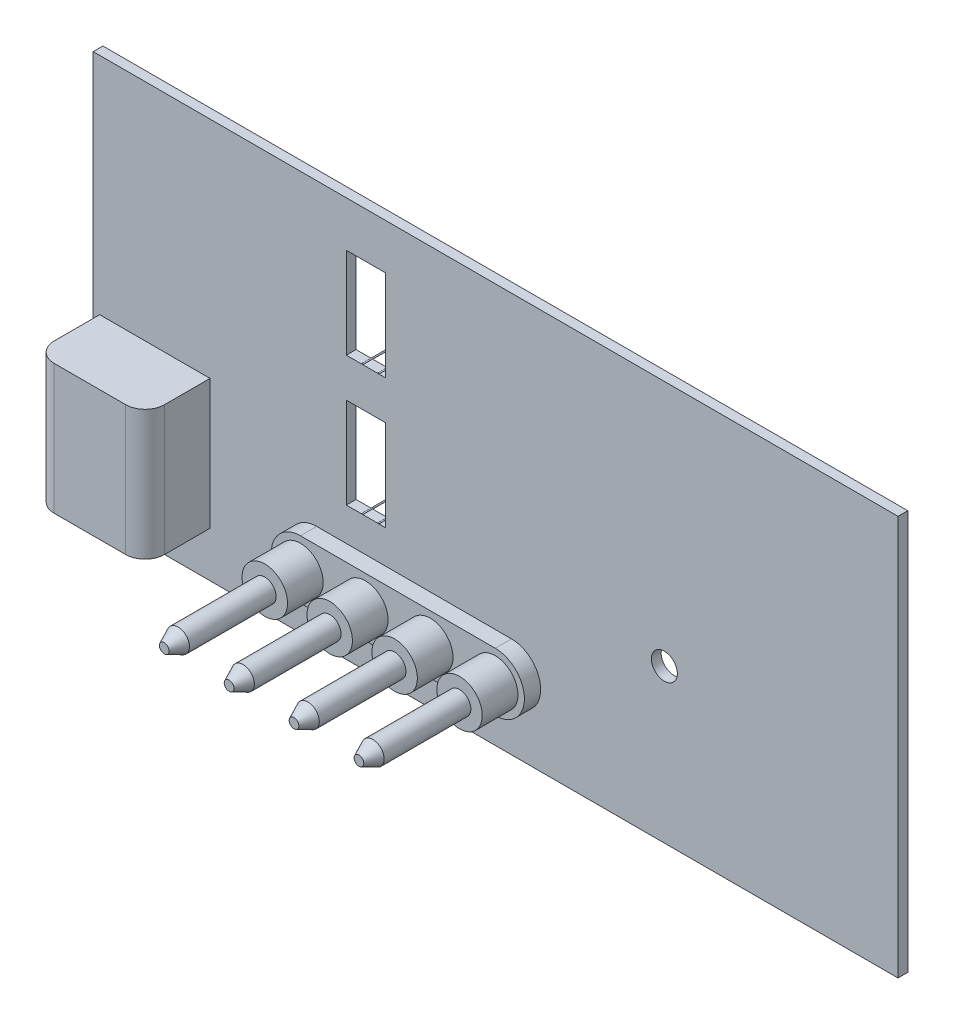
SolidWorks part; units mm, degrees
ref_plane "Plan1" through (0, 0, 0) normal (0, 0, 1) x (1, 0, 0)
ref_plane "Plan2" through (0, 0, 0) normal (0, 1, 0) x (1, 0, 0)
ref_plane "Plan3" through (0, 0, 0) normal (1, 0, 0) x (0, 0, -1)
sketch "Esquisse1" plane through (0, 0, 0) normal (0, 0, 1) x (1, 0, 0)
  line L1 (-88, 38) -> (36, 38)
  line L2 (-88, 38) -> (-88, -23.6)
  line L3 (-88, -23.6) -> (36, -23.6)
  line L4 (36, 38) -> (36, -23.6)
  circle A0 centre (0, 0) radius 2
  dimension "D3" = 4
  dimension "D1" = 124
  dimension "D2" = 61.6
  dimension "D4" = 36
  dimension "D5" = 23.6
extrude "Extrusion1" add sketch "Esquisse1" along normal blind 1.5
sketch "Esquisse2" plane through (0, 0, 1.5) normal (0, 0, 1) x (1, 0, 0)
  line L0 (-88, 38) -> (-88, -23.6) construction
  line L1 (-87, -16.6) -> (-70, -16.6)
  line L2 (-87, 3.4) -> (-87, -16.6)
  line L3 (-87, 3.4) -> (-70, 3.4)
  line L4 (-70, -16.6) -> (-70, 3.4)
  line L5 (-88, -23.6) -> (36, -23.6) construction
  dimension "D1" = 17
  dimension "D2" = 20
  dimension "D3" = 7
  dimension "D4" = 1
extrude "Extrusion2" add sketch "Esquisse2" along normal blind 10
fillet "Congé1" radius 3 2 edges at (-87, -6.6, 11.5) (-70, -6.6, 11.5)
sketch "Esquisse3" plane through (0, 0, 1.5) normal (0, 0, 1) x (1, 0, 0)
  line L1 (-53.56, -8.13) -> (-23.56, -8.13)
  line L3 (-53.56, -17.13) -> (-23.56, -17.13)
  arc A0 (-23.56, -8.13) -> (-23.56, -17.13) centre (-23.56, -12.63) cw
  arc A1 (-53.56, -8.13) -> (-53.56, -17.13) centre (-53.56, -12.63) ccw
  dimension "D1" = 9
  dimension "D2" = 30
  dimension "D3" = 12.63
  dimension "D4" = 23.56
extrude "Extrusion3" add sketch "Esquisse3" along normal blind 2.5
sketch "Esquisse4" plane through (0, 0, 0) normal (0, 0, -1) x (-1, 0, 0)
  circle A0 centre (53.56, -12.63) radius 3.5
  circle A1 centre (43.56, -12.63) radius 3.5
  circle A2 centre (33.56, -12.63) radius 3.5
  circle A3 centre (23.56, -12.63) radius 3.5
  dimension "D1" = 7
extrude "Extrusion4" add sketch "Esquisse4" against normal blind 9.5
sketch "Esquisse5" plane through (0, 0, 0) normal (0, 0, -1) x (-1, 0, 0)
  circle A0 centre (53.56, -12.63) radius 1.75
  circle A1 centre (43.56, -12.63) radius 1.75
  circle A2 centre (33.56, -12.63) radius 1.75
  circle A3 centre (23.56, -12.63) radius 1.75
  dimension "D1" = 3.5
extrude "Extrusion5" add sketch "Esquisse5" against normal blind 25
chamfer "Chanfrein1" distance 1 angle 65 4 edges at (-25.31, -12.63, 25) (-35.31, -12.63, 25) (-45.31, -12.63, 25) (-55.31, -12.63, 25)
sketch "Esquisse6" plane through (0, 0, 1.5) normal (0, 0, 1) x (1, 0, 0)
  line L0 (36, 38) -> (-88, 38) construction
  line L1 (-49, -3) -> (-43, -3)
  line L2 (-49, -3) -> (-49, 11)
  line L3 (-49, 11) -> (-43, 11)
  line L4 (-43, -3) -> (-43, 11)
  line L5 (-49, 17) -> (-43, 17)
  line L6 (-49, 17) -> (-49, 31)
  line L7 (-49, 31) -> (-43, 31)
  line L8 (-43, 17) -> (-43, 31)
  dimension "D1" = 14
  dimension "D2" = 14
  dimension "D3" = 6
  dimension "D4" = 6
  dimension "D5" = 43
  dimension "D6" = 7
  dimension "D7" = 6
extrude "Enlèv. mat.-Extru.1" cut sketch "Esquisse6" against normal blind 10
sketch "Esquisse8" plane through (0, 0, 0) normal (0, 0, -1) x (-1, 0, 0)
  line L0 (49, 17) -> (43, 17) construction
  circle A0 centre (45.31, -3) radius 2.5
  circle A1 centre (45.31, 17) radius 2.5
  dimension "D1" = 5
  dimension "D4" = 5
  dimension "D2" = 3
  dimension "D3" = 45.31
extrude "Extrusion6" add sketch "Esquisse8" along normal blind 7 from offset 6
fillet "Congé2" radius 2 1 edges at (-47.81, -3, -13)
fillet "Congé3" radius 2 1 edges at (-47.81, 17, -13)
sketch "Esquisse9" plane through (0, 0, -6) normal (0, 0, 1) x (1, 0, 0)
  circle A0 centre (-45.31, -3) radius 3
  circle A1 centre (-45.31, 17) radius 3
  dimension "D1" = 6
  dimension "D2" = 6
extrude "Extrusion7" add sketch "Esquisse9" along normal blind 1
sketch "Esquisse10" plane through (0, 0, -5) normal (0, 0, 1) x (1, 0, 0)
  line L0 (-49, -3) -> (-43, -3) construction
  circle A0 centre (-46.56, -3) radius 0.1
  circle A1 centre (-44.06, -3) radius 0.1
  circle A2 centre (-45.31, -3) radius 2.5 construction
  circle A3 centre (-46.56, 17) radius 0.1
  circle A4 centre (-44.06, 17) radius 0.1
  dimension "D3" = 0.2
  dimension "D4" = 0.2
  dimension "D1" = 1.25
  dimension "D2" = 1.25
extrude "Extrusion8" add sketch "Esquisse10" along normal up to surface (6.5 mm away) separate body
sketch "Esquisse11" plane through (0, 0, 0) normal (0, 0, -1) x (-1, 0, 0)
  circle A0 centre (45.31, -22.5) radius 2.5
  point P0 (45.31, -22.5)
  dimension "D3" = 5
  dimension "D1" = 45.31
  dimension "D2" = 22.5
extrude "Extrusion9" add sketch "Esquisse11" along normal blind 1 from offset 1.5
sketch "Esquisse12" plane through (0, 0, -2.5) normal (0, 0, -1) x (-1, 0, 0)
  circle A0 centre (45.31, -22.5) radius 2
  dimension "D1" = 4
extrude "Extrusion10" add sketch "Esquisse12" along normal blind 8
fillet "Congé4" radius 2 1 edges at (-47.31, -22.5, -10.5)
sketch "Esquisse13" plane through (0, 0, 1.5) normal (0, 0, 1) x (1, 0, 0)
  line L0 (-88, -23.6) -> (36, -23.6) construction
  circle A0 centre (-46.4593, -23.6) radius 0.1
  circle A1 centre (-45.3695, -23.6) radius 0.1
  circle A2 centre (-44.2603, -23.6) radius 0.1
  dimension "D1" = 0.2
  dimension "D2" = 0.2
  dimension "D3" = 0.2
extrude "Extrusion11" add sketch "Esquisse13" against normal up to next (4 mm away)
sketch "Esquisse14" plane through (0, 0, 0) normal (0, 0, -1) x (-1, 0, 0)
  line L2 (55.31, -17.5371) -> (55.31, -20.1829)
  line L4 (58.31, -17.5371) -> (58.31, -20.1829)
  arc A0 (58.31, -17.5371) -> (55.31, -17.5371) centre (56.81, -18.86) ccw
  arc A1 (55.31, -20.1829) -> (58.31, -20.1829) centre (56.81, -18.86) ccw
  point P0 (56.81, -18.86)
  point P3 (0, 0)
  point P8 (62.9191, 0.4494)
  point P10 (58.7527, -19.3353)
  dimension "D3" = 2
  dimension "D5" = 2
  dimension "D1" = 56.81
  dimension "D2" = 18.86
  dimension "D4" = 3
  dimension "D6" = 1.5
extrude "Extrusion12" add sketch "Esquisse14" along normal blind 1 from offset 3
sketch "Esquisse15" plane through (0, 0, -4) normal (0, 0, -1) x (-1, 0, 0)
  circle A0 centre (56.81, -18.86) radius 1.5
extrude "Extrusion13" add sketch "Esquisse15" along normal blind 3
fillet "Congé5" radius 1.5 1 edges at (-58.31, -18.86, -7)
